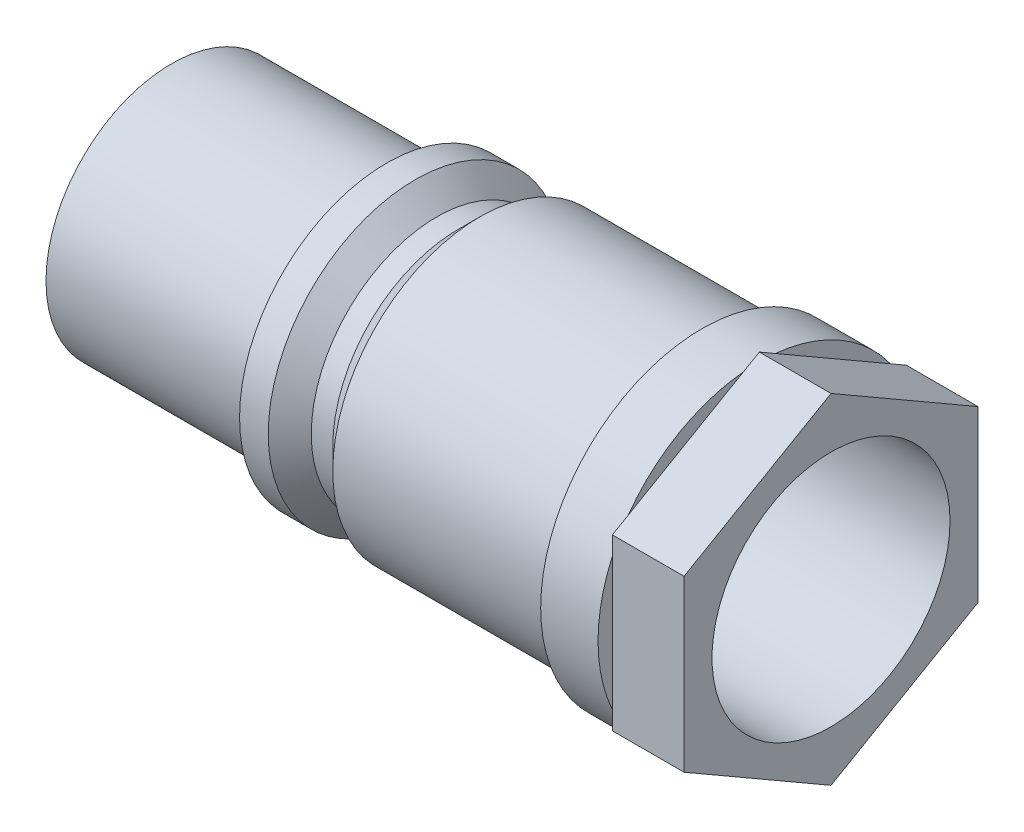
SolidWorks part; units mm, degrees
ref_plane "Alzado" through (0, 0, 0) normal (0, 0, 1) x (1, 0, 0)
ref_plane "Planta" through (0, 0, 0) normal (0, 1, 0) x (1, 0, 0)
ref_plane "Vista lateral" through (0, 0, 0) normal (1, 0, 0) x (0, 0, -1)
sketch "Croquis1" plane through (0, 0, 0) normal (0, 0, 1) x (1, 0, 0)
  line L0 (0, 0) -> (82, 0) construction
  line L1 (0, 0) -> (0, 17.5)
  line L2 (0, 17.5) -> (30, 17.5)
  line L3 (30, 17.5) -> (30, 20.5)
  line L4 (30, 20.5) -> (34, 20.5)
  line L5 (34, 20.5) -> (37, 17.5)
  line L6 (37, 17.5) -> (40, 17.5)
  line L7 (40, 17.5) -> (43, 20.5)
  line L8 (43, 20.5) -> (74, 20.5)
  line L9 (74, 20.5) -> (74, 22.5)
  line L10 (74, 22.5) -> (82, 22.5)
  line L11 (82, 22.5) -> (82, 0)
  line L12 (0, 0) -> (82, 0)
  dimension "D1" = 35
  dimension "D2" = 82
  dimension "D3" = 8
  dimension "D4" = 2
  dimension "D5" = 30
  dimension "D6" = 4
  dimension "D7" = 3
  dimension "D8" = 3
  dimension "D9" = 225
revolve "Revolución1" add sketch "Croquis1" angle 360 about L0
sketch "Croquis2" plane through (82, 0, 0) normal (1, 0, 0) x (0, 0, -1)
  line L1 (0, 23.6714) -> (-20.5, 11.8357)
  line L2 (-20.5, 11.8357) -> (-20.5, -11.8357)
  line L3 (-20.5, -11.8357) -> (0, -23.6714)
  line L4 (0, -23.6714) -> (20.5, -11.8357)
  line L5 (20.5, -11.8357) -> (20.5, 11.8357)
  line L6 (20.5, 11.8357) -> (0, 23.6714)
  circle A0 centre (0, 0) radius 20.5 construction
  dimension "D1" = 41
extrude "Saliente-Extruir1" add sketch "Croquis2" along normal blind 10
sketch "Croquis3" plane through (92, 0, 0) normal (1, 0, 0) x (0, 0, -1)
  circle A0 centre (0, 0) radius 16.6
  dimension "D1" = 33.2
extrude "Cortar-Extruir1" cut sketch "Croquis3" against normal through all
